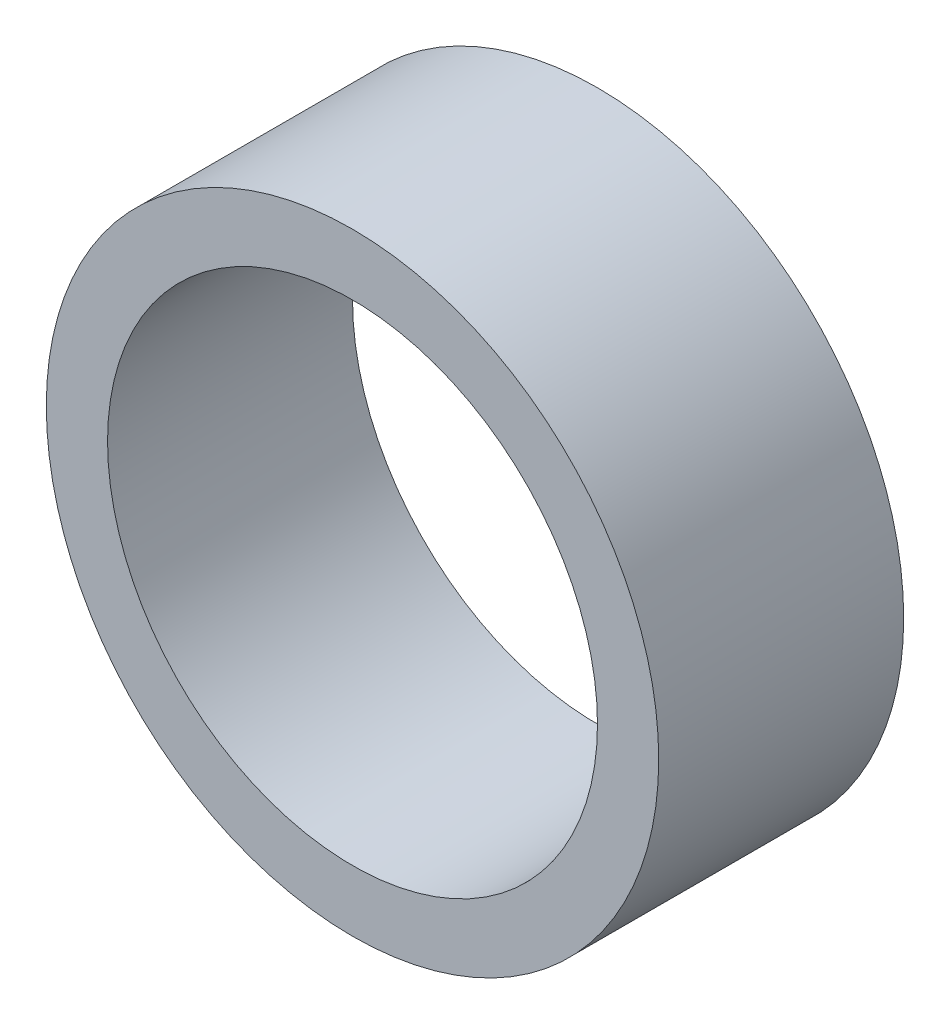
SolidWorks part; units mm, degrees
ref_plane "Front" through (0, 0, 0) normal (0, 0, 1) x (1, 0, 0)
ref_plane "Top" through (0, 0, 0) normal (0, 1, 0) x (1, 0, 0)
ref_plane "Right" through (0, 0, 0) normal (1, 0, 0) x (0, 0, -1)
sketch "Logo3_Revol_Axis" plane through (0, 0, 0) normal (0, 1, 0) x (1, 0, 0)
  line L0 (0, -30.1653) -> (0, 30.1653) construction
sketch "Logo3_bib1" plane through (0, 0, 0) normal (0, -1, 0) x (-1, 0, 0)
  line L0 (7.9375, 0) -> (6.35, 0)
  line L1 (6.35, 0) -> (6.35, -6.35)
  line L2 (6.35, -6.35) -> (7.9375, -6.35)
  line L3 (7.1438, 0) -> (7.1438, -6.35) construction
  line L4 (7.9375, -6.35) -> (7.9375, 0)
  line L5 (7.9375, -3.175) -> (6.35, -3.175) construction
  line L10 (0, 38.9764) -> (0, -41.3764) construction
  point P11 (6.35, 0)
  point P15 (6.35, -6.35)
revolve "Revolve1" add sketch "Logo3_bib1" angle 360 about L10
equation "\"D2@Logo3_bib1\"=\"logo3_l1@Logo3_bib1\"/2"
equation "\"D3@Logo3_bib1\"=(\"logo3_d1@Logo3_bib1\"-\"logo3_d_in@Logo3_bib1\")/4"
